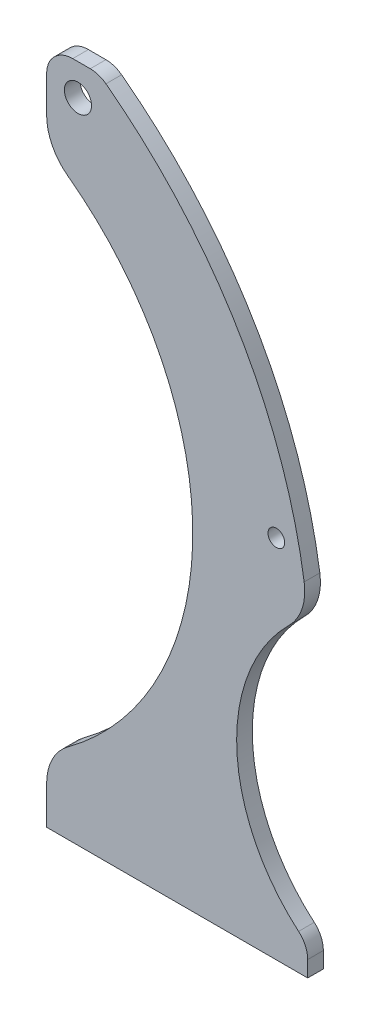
SolidWorks part; units mm, degrees
ref_plane "Plan de face" through (0, 0, 0) normal (0, 0, 1) x (1, 0, 0)
ref_plane "Plan de dessus" through (0, 0, 0) normal (0, 1, 0) x (1, 0, 0)
ref_plane "Plan de droite" through (0, 0, 0) normal (1, 0, 0) x (0, 0, -1)
sketch "Esquisse1" plane through (0, 0, 0) normal (0, 0, 1) x (1, 0, 0)
  line L1 (-27.9378, 53.975) -> (22.0622, 53.975)
  line L2 (-27.9378, 53.975) -> (-27.9378, -76.025)
  line L3 (-27.9378, -76.025) -> (22.0622, -76.025)
  line L4 (22.0622, 53.975) -> (22.0622, -76.025)
  dimension "D2" = 130
extrude "Extrusion1" add sketch "Esquisse1" along normal blind 3
ref_plane "Plan1" through (-27.9378, 53.975, 3) normal (-1, 0, 0) x (0, 0, 1)
ref_plane "Plan2" through (-27.9378, 53.975, 3) normal (-1, 0, 0) x (0, 0, 1)
sketch "Esquisse3" plane through (0, 0, 3) normal (0, 0, 1) x (1, 0, 0)
  line L0 (-7.9378, 53.975) -> (22.0622, 3.975)
  line L1 (22.0622, 53.975) -> (-27.9378, 53.975) construction
  line L2 (22.0622, -76.025) -> (22.0622, 53.975) construction
  line L3 (-27.9378, 53.975) -> (-27.9378, -76.025) construction
  line L4 (-27.9378, -76.025) -> (22.0622, -76.025) construction
  line L5 (-7.9378, 53.975) -> (22.0622, 53.975)
  line L6 (22.0622, 53.975) -> (22.0622, 3.975)
  circle A0 centre (-21.9378, 47.975) radius 2.6
  circle A1 centre (16.0622, -6.025) radius 1.6
  dimension "D3" = 5.2
  dimension "D4" = 6
  dimension "D5" = 6
  dimension "D6" = 6
  dimension "D7" = 70
  dimension "D8" = 3.2
  dimension "D1" = 20
  dimension "D2" = 80
extrude "Enlèv. mat.-Extru.1" cut sketch "Esquisse3" against normal blind 6
sketch "Esquisse4" plane through (0, 0, 3) normal (0, 0, 1) x (1, 0, 0)
  line L0 (-27.9378, 67.725) -> (-27.9378, 40.225) construction
  line L1 (-7.9378, 53.975) -> (-27.9378, 53.975) construction
  line L2 (22.0622, -76.025) -> (22.0622, 3.975) construction
  line L3 (-27.9378, 36.7856) -> (-27.9378, -63.408)
  line L4 (-17.9378, 53.975) -> (9.1226, 53.975)
  line L5 (9.1226, 53.975) -> (35.0987, 7.6288)
  line L6 (35.0987, 7.6288) -> (22.0622, -70.5647)
  arc A0 (-27.9378, -63.408) -> (-27.9378, 36.7856) centre (-58.7765, -13.3112) ccw
  arc A1 (-17.9378, 53.975) -> (22.0622, -16.2269) centre (-75.3284, -25.222) cw
  arc A2 (22.0622, -16.2269) -> (22.0622, -70.5647) centre (42.3827, -43.3958) ccw
extrude "Enlèv. mat.-Extru.2" cut sketch "Esquisse4" against normal blind 20
fillet "Congé1" radius 10 3 edges at (-27.9378, 36.7856, 1.5) (-27.9378, -63.408, 1.5) (22.0622, -16.2269, 1.5)
fillet "Congé2" radius 5 3 edges at (22.0622, -70.5647, 1.5) (-17.9378, 53.975, 1.5) (-27.9378, 53.975, 1.5)
